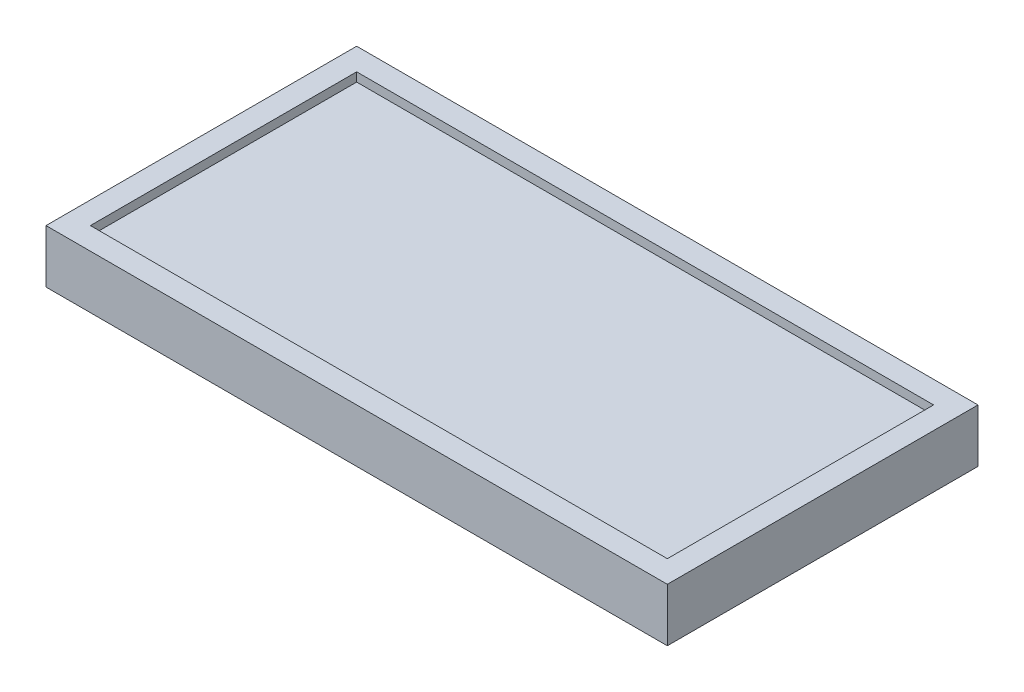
SolidWorks part; units mm, degrees
ref_plane "Front Plane" through (0, 0, 0) normal (0, 0, 1) x (1, 0, 0)
ref_plane "Top Plane" through (0, 0, 0) normal (0, 1, 0) x (1, 0, 0)
ref_plane "Right Plane" through (0, 0, 0) normal (1, 0, 0) x (0, 0, -1)
sketch "Sketch1" plane through (0, 0, 0) normal (0, 1, 0) x (1, 0, 0)
  line L1 (0, 0) -> (177.8, 0)
  line L2 (0, 0) -> (0, 88.9)
  line L3 (0, 88.9) -> (177.8, 88.9)
  line L4 (177.8, 0) -> (177.8, 88.9)
  dimension "D1" = 88.9
  dimension "D2" = 177.8
extrude "Boss-Extrude1" add sketch "Sketch1" along normal blind 12.7
sketch "Sketch2" plane through (0, 12.7, 0) normal (0, 1, 0) x (1, 0, 0)
  line L1 (0, 0) -> (177.8, 0)
  line L2 (0, 0) -> (0, 88.9)
  line L3 (0, 88.9) -> (177.8, 88.9)
  line L4 (177.8, 0) -> (177.8, 88.9)
  line L5 (6.35, 6.35) -> (171.45, 6.35)
  line L6 (6.35, 6.35) -> (6.35, 82.55)
  line L7 (6.35, 82.55) -> (171.45, 82.55)
  line L8 (171.45, 6.35) -> (171.45, 82.55)
  dimension "D1" = 6.35
  dimension "D2" = 6.35
  dimension "D3" = 6.35
  dimension "D4" = 6.35
extrude "Boss-Extrude2" add sketch "Sketch2" along normal blind 2.54
